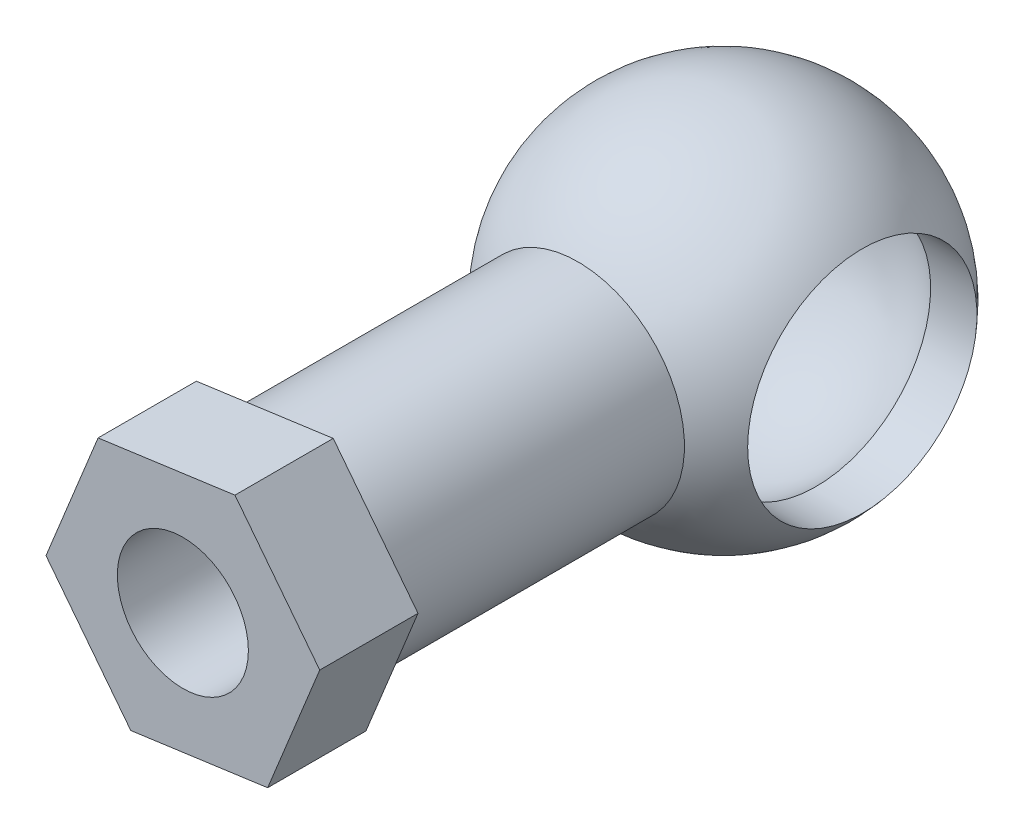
SolidWorks part; units mm, degrees
ref_plane "Plan de face" through (0, 0, 0) normal (0, 0, 1) x (1, 0, 0)
ref_plane "Plan de dessus" through (0, 0, 0) normal (0, 1, 0) x (1, 0, 0)
ref_plane "Plan de droite" through (0, 0, 0) normal (1, 0, 0) x (0, 0, -1)
sketch "Esquisse1" plane through (0, 0, 0) normal (0, 0, 1) x (1, 0, 0)
  line L0 (0, 19.1255) -> (0, -27.0838) construction
  line L1 (0, 11) -> (0, 9)
  line L2 (0, -9) -> (0, -11)
  arc A0 (0, 11) -> (0, -11) centre (0, 0) ccw
  arc A1 (0, 9) -> (0, -9) centre (0, 0) ccw
  dimension "D1" = 22
  dimension "D2" = 2
revolve "Révolution1" add sketch "Esquisse1" angle 360 about L0
sketch "Esquisse2" plane through (0, 0, 0) normal (1, 0, 0) x (0, 0, -1)
  circle A0 centre (0, 0) radius 7
  dimension "D1" = 14
extrude "Extrusion1" cut sketch "Esquisse2" along normal blind 30
sketch "Esquisse3" plane through (0, 0, 0) normal (0, 1, 0) x (1, 0, 0)
  line L0 (0, 0) -> (0, -18.5715) construction
  line L1 (0, -11) -> (0, -27)
  line L2 (-6.5, -8.8741) -> (-6.5, -27)
  line L3 (-6.5, -27) -> (0, -27)
  arc A0 (-6.5, -8.8741) -> (0, -11) centre (0, 0) ccw
  dimension "D1" = 27
  dimension "D2" = 6.5
revolve "Révolution2" add sketch "Esquisse3" angle 360 about L0
sketch "Esquisse4" plane through (0, 0, 27) normal (0, 0, 1) x (1, 0, 0)
  line L1 (5.177, -6.6612) -> (8.3573, 1.1528)
  line L2 (8.3573, 1.1528) -> (3.1803, 7.8141)
  line L3 (3.1803, 7.8141) -> (-5.177, 6.6612)
  line L4 (-5.177, 6.6612) -> (-8.3573, -1.1528)
  line L5 (-8.3573, -1.1528) -> (-3.1803, -7.8141)
  line L6 (-3.1803, -7.8141) -> (5.177, -6.6612)
  circle A0 centre (0, 0) radius 7.3062 construction
  circle A1 centre (0, 0) radius 4
  dimension "D1" = 8
extrude "Extrusion2" add sketch "Esquisse4" along normal blind 6
